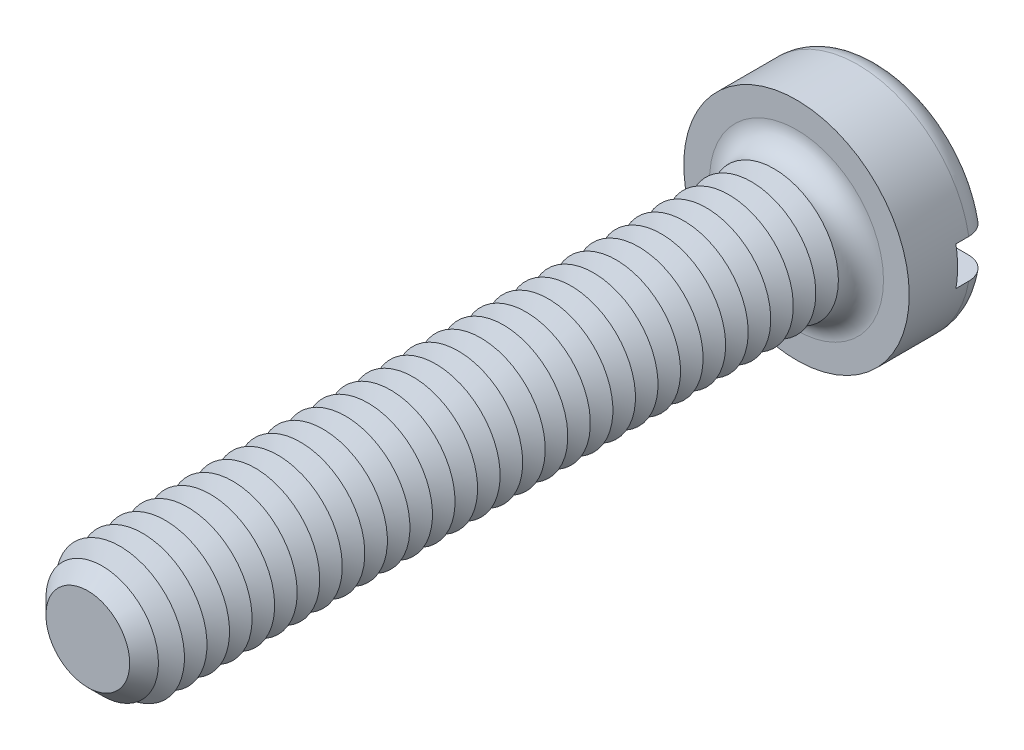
SolidWorks part; units mm, degrees
ref_plane "Front Plane" through (0, 0, 0) normal (0, 0, 1) x (1, 0, 0)
ref_plane "Top Plane" through (0, 0, 0) normal (0, 1, 0) x (1, 0, 0)
ref_plane "Right Plane" through (0, 0, 0) normal (1, 0, 0) x (0, 0, -1)
sketch "Sketch3" plane through (0, 0, 0) normal (0, 0, 1) x (1, 0, 0)
  circle A0 centre (0, 0) radius 3.5
  dimension "D1" = 7
extrude "Boss-Extrude2" add sketch "Sketch3" against normal blind 2.6
sketch "Sketch4" plane through (0, 0, 0) normal (0, 0, 1) x (1, 0, 0)
  circle A0 centre (0, 0) radius 2
  dimension "D1" = 4
extrude "Boss-Extrude3" add sketch "Sketch4" along normal blind 22
fillet "Fillet1" radius 0.7 2 edges at (3.5, 0, -2.6) (2, 0, 0)
chamfer "Chamfer1" distance 0.7 angle 45 1 edges at (2, 0, 22)
sketch "Sketch5" plane through (0, 0, 0) normal (1, 0, 0) x (0, 0, -1)
  line L0 (1.6944, 0) -> (-7.6738, 0) construction
sketch "Sketch6" plane through (0, 0, 0) normal (1, 0, 0) x (0, 0, -1)
  line L0 (-0.7, 2) -> (-1.05, 1.3938)
  line L1 (-1.05, 1.3938) -> (-1.4, 2)
  line L2 (-0.7, 2) -> (-21.3, 2) construction
  line L3 (-1.4, 2) -> (-0.7, 2)
  dimension "D1" = 0.7
revolve "Cut-Revolve1" cut sketch "Sketch6" angle 360 about L0
pattern_linear "LPattern1" count 30 spacing 0.7 along (0, 0, 1) of "Cut-Revolve1"
sketch "Sketch8" plane through (0, 0, -2.6) normal (0, 0, -1) x (-1, 0, 0)
  line L1 (3.5, -0.6) -> (-3.5, -0.6)
  line L2 (3.5, -0.6) -> (3.5, 0.6)
  line L3 (3.5, 0.6) -> (-3.5, 0.6)
  line L4 (-3.5, -0.6) -> (-3.5, 0.6)
  line L5 (3.5, -0.6) -> (-3.5, 0.6) construction
  line L6 (3.5, 0.6) -> (-3.5, -0.6) construction
  point P0 (0, 0)
  dimension "D1" = 7
  dimension "D2" = 1.2
extrude "Cut-Extrude1" cut sketch "Sketch8" against normal blind 1.1
